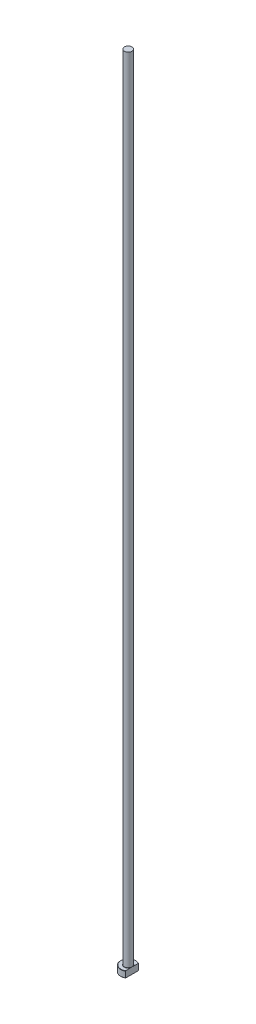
SolidWorks part; units mm, degrees
ref_plane "Front Plane" through (0, 0, 0) normal (0, 0, 1) x (1, 0, 0)
ref_plane "Top Plane" through (0, 0, 0) normal (0, 1, 0) x (1, 0, 0)
ref_plane "Right Plane" through (0, 0, 0) normal (1, 0, 0) x (0, 0, -1)
sketch "Sketch1" plane through (0, 0, 0) normal (0, 0, 1) x (1, 0, 0)
  line L0 (0, 259.9588) -> (0, -15.1925) construction
  line L1 (0, 0) -> (-6, 0)
  line L2 (-6, 0) -> (-6, 5)
  line L3 (-6, 5) -> (-3, 5)
  line L4 (-3, 5) -> (-3, 630)
  line L5 (-3, 630) -> (0, 630)
  line L6 (0, 630) -> (0, 0)
  dimension "L" = 630
  dimension "H" = 12
  dimension "T" = 5
  dimension "D" = 6
revolve "Revolve1" add sketch "Sketch1" angle 360 about L0
chamfer "Chamfer1" distance 0.2 angle 45 2 edges at (0, 5, 6) (0, 0, 6)
fillet "Fillet1" radius 0.2 1 edges at (0, 5, 3)
sketch "Sketch2" plane through (0, 0, 0) normal (0, 1, 0) x (1, 0, 0)
  line L0 (3, 5.1962) -> (3, -5.1962)
  circle A0 centre (0, 0) radius 6 construction
  arc A1 (3, -5.1962) -> (3, 5.1962) centre (0, 0) ccw
  circle A2 centre (0, 0) radius 3 construction
extrude "KEY" cut sketch "Sketch2" along normal through all
